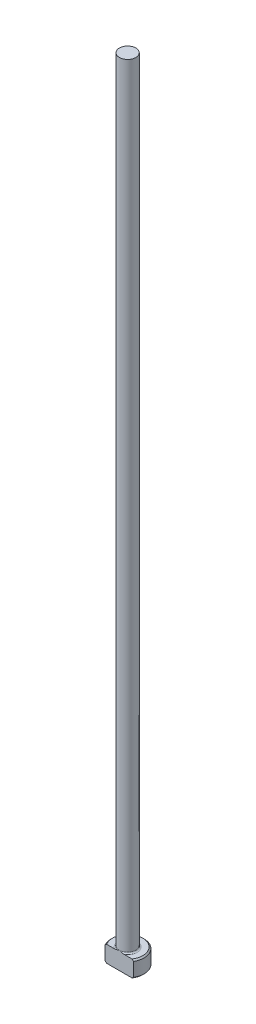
SolidWorks part; units mm, degrees
ref_plane "Front Plane" through (0, 0, 0) normal (0, 0, 1) x (1, 0, 0)
ref_plane "Top Plane" through (0, 0, 0) normal (0, 1, 0) x (1, 0, 0)
ref_plane "Right Plane" through (0, 0, 0) normal (1, 0, 0) x (0, 0, -1)
sketch "Sketch1" plane through (0, 0, 0) normal (0, 0, 1) x (1, 0, 0)
  line L0 (0, 259.9588) -> (0, -15.1925) construction
  line L1 (0, 0) -> (-3.175, 0)
  line L2 (-3.175, 0) -> (-3.175, 3.175)
  line L3 (-3.175, 3.175) -> (-1.5875, 3.175)
  line L4 (-1.5875, 3.175) -> (-1.5875, 152.4)
  line L5 (-1.5875, 152.4) -> (0, 152.4)
  line L6 (0, 152.4) -> (0, 0)
  dimension "L" = 152.4
  dimension "H" = 6.35
  dimension "T" = 3.175
  dimension "D" = 3.175
revolve "Revolve1" add sketch "Sketch1" angle 360 about L0
chamfer "Chamfer1" distance 0.254 angle 45 2 edges at (0, 3.175, 3.175) (0, 0, 3.175)
fillet "Fillet1" radius 0.254 1 edges at (0, 3.175, 1.5875)
sketch "Sketch2" plane through (0, 0, 0) normal (0, 1, 0) x (1, 0, 0)
  line L0 (-2.7496, -1.5875) -> (2.7496, -1.5875)
  circle A0 centre (0, 0) radius 3.175 construction
  arc A1 (-2.7496, -1.5875) -> (2.7496, -1.5875) centre (0, 0) ccw
  circle A3 centre (0, 0) radius 1.5875 construction
  dimension "D1" = 0
extrude "Key" cut sketch "Sketch2" along normal through all
sketch "Pocket Sketch" plane through (0, 0, 0) normal (0, 0, 1) x (1, 0, 0)
  line L0 (-3.5719, 0) -> (-3.5719, 3.2004)
  line L1 (-3.5719, 3.2004) -> (-2.5479, 3.2004)
  line L2 (-1.7859, 3.9624) -> (-1.7859, 22.225)
  line L3 (-1.7859, 22.225) -> (0, 22.225)
  line L4 (0, 22.225) -> (0, 0)
  line L5 (0, 0) -> (-3.5719, 0)
  line L6 (0, 12.6104) -> (0, -2.4989) construction
  line L7 (-3.175, 2.921) -> (-3.175, 0.254) construction
  line L8 (2.921, 3.175) -> (-2.921, 3.175) construction
  line L9 (-1.5875, 152.4) -> (-1.5875, 3.429) construction
  line L10 (-2.5479, 3.2004) -> (-1.7859, 3.9624)
  point P3 (-1.7859, 3.2004)
  dimension "D1" = 7.1437
  dimension "D2" = 0.3969
  dimension "D3" = 0.0254
  dimension "D4" = 0.1984
  dimension "D5" = 3.5719
  dimension "D6" = 22.225
